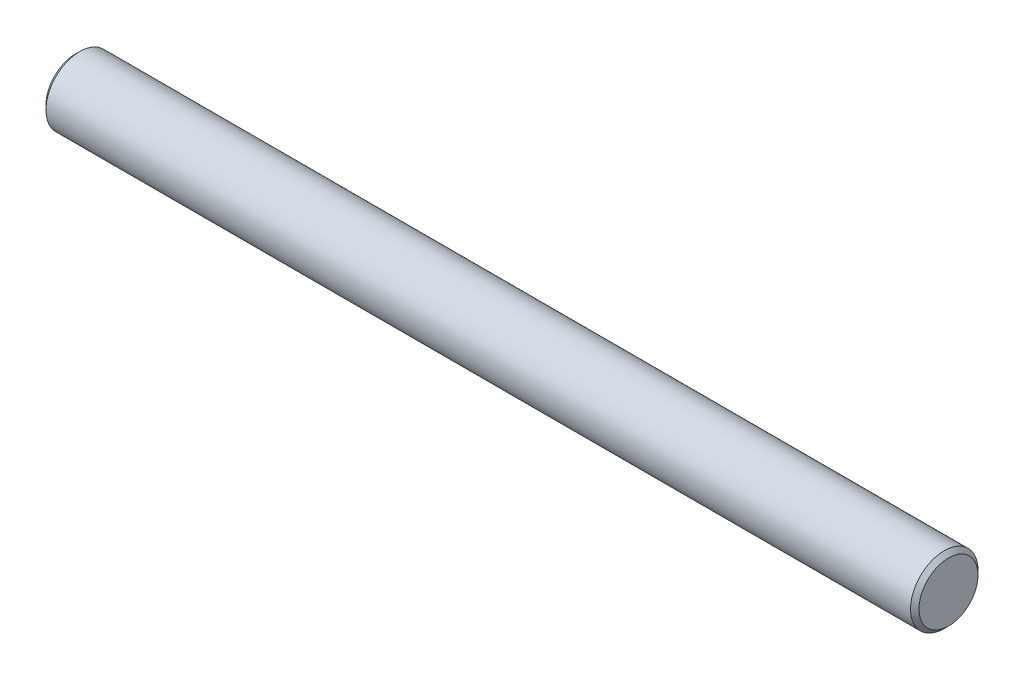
SolidWorks part; units mm, degrees
ref_plane "Front" through (0, 0, 0) normal (0, 0, 1) x (1, 0, 0)
ref_plane "Top" through (0, 0, 0) normal (0, 1, 0) x (1, 0, 0)
ref_plane "Right" through (0, 0, 0) normal (1, 0, 0) x (0, 0, -1)
sketch "Sketch1" plane through (0, 0, 0) normal (1, 0, 0) x (0, 0, -1)
  circle A0 centre (0, 0) radius 8
  dimension "D1" = 16
extrude "Extrude1" add sketch "Sketch1" along normal blind 207
chamfer "Chamfer1" distance 1 angle 45 2 edges at (0, 0, -8) (207, 0, -8)
